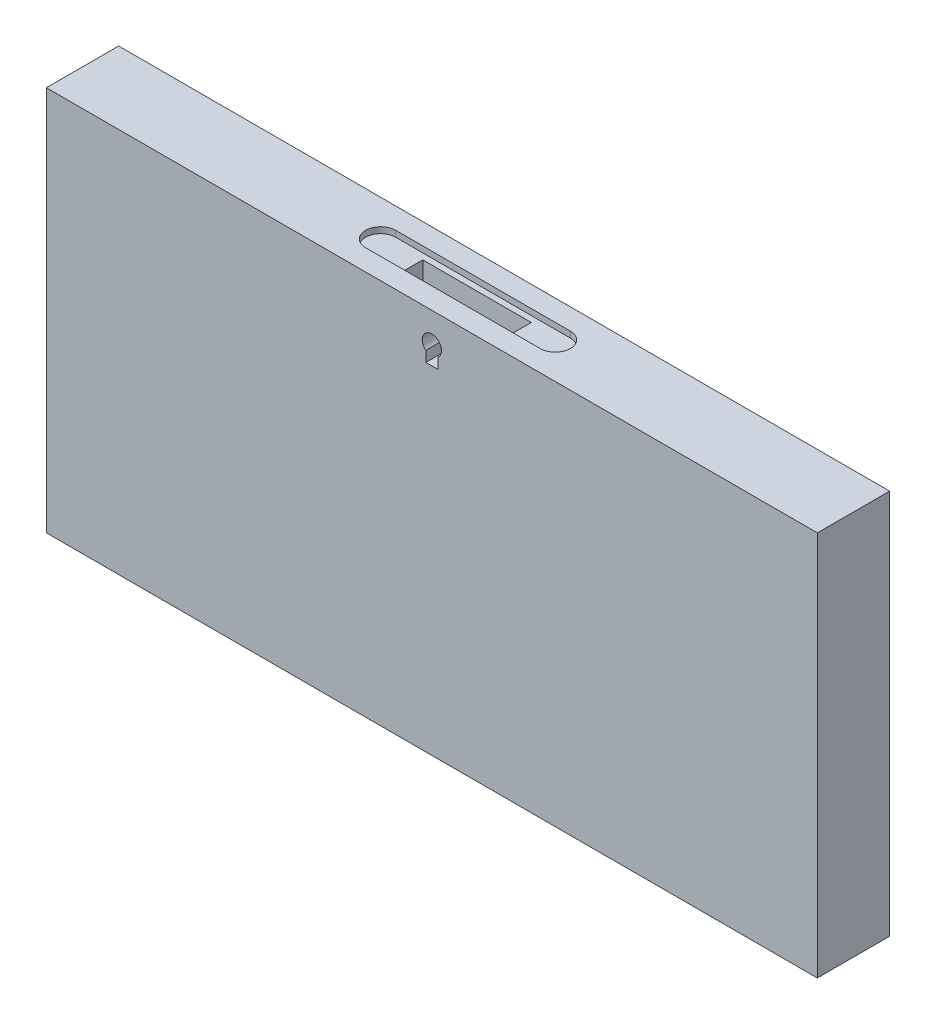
SolidWorks part; units mm, degrees
ref_plane "Front Plane" through (0, 0, 0) normal (0, 0, 1) x (1, 0, 0)
ref_plane "Top Plane" through (0, 0, 0) normal (0, 1, 0) x (1, 0, 0)
ref_plane "Right Plane" through (0, 0, 0) normal (1, 0, 0) x (0, 0, -1)
sketch "Sketch1" plane through (0, 0, 0) normal (0, 1, 0) x (1, 0, 0)
  line L1 (0, 0) -> (203.2, 0)
  line L2 (0, 0) -> (0, 19.05)
  line L3 (0, 19.05) -> (203.2, 19.05)
  line L4 (203.2, 0) -> (203.2, 19.05)
  dimension "D1" = 19.05
  dimension "D2" = 203.2
extrude "Extrude1" add sketch "Sketch1" against normal blind 101.6
sketch "Sketch2" plane through (0, 0, 0) normal (0, 1, 0) x (1, 0, 0)
  line L2 (78.5812, 5.5563) -> (124.6188, 5.5563)
  line L3 (124.6188, 13.4938) -> (78.5812, 13.4938)
  line L4 (78.5812, 5.5563) -> (124.6188, 5.5563)
  line L5 (124.6188, 13.4938) -> (78.5812, 13.4938)
  arc A2 (78.5812, 13.4938) -> (78.5812, 5.5563) centre (78.5812, 9.525) ccw
  arc A3 (124.6188, 5.5563) -> (124.6188, 13.4938) centre (124.6188, 9.525) ccw
  arc A4 (78.5812, 13.4938) -> (78.5812, 5.5563) centre (78.5812, 9.525) ccw
  arc A5 (124.6188, 5.5563) -> (124.6188, 13.4938) centre (124.6188, 9.525) ccw
  dimension "D1" = 0
extrude "Cut-Extrude1" cut sketch "Sketch2" against normal blind 1.5875
sketch "Sketch3" plane through (0, -1.5875, 0) normal (0, 1, 0) x (1, 0, 0)
  line L4 (115.8875, 7.1438) -> (115.8875, 11.9062)
  line L5 (87.3125, 7.1438) -> (115.8875, 7.1438)
  line L6 (87.3125, 11.9062) -> (87.3125, 7.1438)
  line L7 (115.8875, 11.9062) -> (87.3125, 11.9062)
  line L8 (115.8875, 7.1438) -> (115.8875, 11.9062)
  line L9 (87.3125, 7.1438) -> (115.8875, 7.1438)
  line L10 (87.3125, 11.9062) -> (87.3125, 7.1438)
  line L11 (115.8875, 11.9062) -> (87.3125, 11.9062)
  dimension "D1" = 0
extrude "Cut-Extrude2" cut sketch "Sketch3" against normal blind 15.875
sketch "Sketch4" plane through (0, 0, 0) normal (0, 0, 1) x (1, 0, 0)
  line L1 (100.0125, -9.9203) -> (100.0125, -12.7) construction
  line L2 (100.0125, -9.9203) -> (100.0125, -12.7)
  line L3 (100.0125, -12.7) -> (103.1875, -12.7) construction
  line L4 (100.0125, -12.7) -> (103.1875, -12.7)
  line L5 (103.1875, -12.7) -> (103.1875, -9.9203) construction
  line L6 (103.1875, -12.7) -> (103.1875, -9.9203)
  arc A0 (103.1875, -9.9203) -> (100.0125, -9.9203) centre (101.6, -7.9375) ccw construction
  arc A1 (103.1875, -9.9203) -> (100.0125, -9.9203) centre (101.6, -7.9375) ccw
extrude "Cut-Extrude3" cut sketch "Sketch4" against normal up to body separate body
